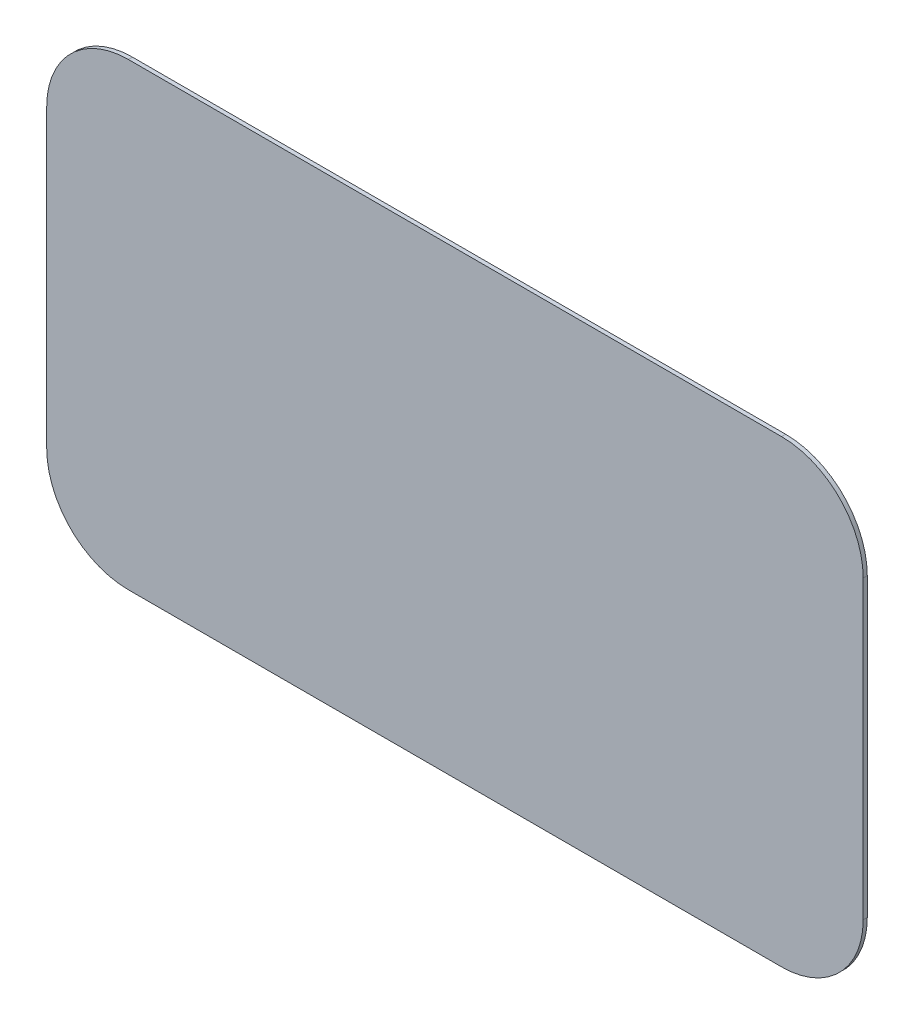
SolidWorks part; units mm, degrees
ref_plane "Спереди" through (0, 0, 0) normal (0, 0, 1) x (1, 0, 0)
ref_plane "Сверху" through (0, 0, 0) normal (0, 1, 0) x (1, 0, 0)
ref_plane "Справа" through (0, 0, 0) normal (1, 0, 0) x (0, 0, -1)
other "Configuration Table"
sketch "Эскиз1" plane through (0, 0, 0) normal (0, 0, 1) x (1, 0, 0)
  line L1 (-10, 5.625) -> (10, 5.625)
  line L2 (-10, 5.625) -> (-10, -5.625)
  line L3 (-10, -5.625) -> (10, -5.625)
  line L4 (10, 5.625) -> (10, -5.625)
  line L5 (0, -5.625) -> (0, 5.625) construction
  line L6 (-10, 0) -> (10, 0) construction
  point P0 (0, 0)
extrude "Бобышка-Вытянуть1" add sketch "Эскиз1" along normal blind 0.1
fillet "Скругление1" radius 2 4 edges at (-10, -5.625, 0.05) (-10, 5.625, 0.05) (10, -5.625, 0.05) (10, 5.625, 0.05)
equation "\"D2@Эскиз1\"=(\"D1@Эскиз1\"/16)*9"
